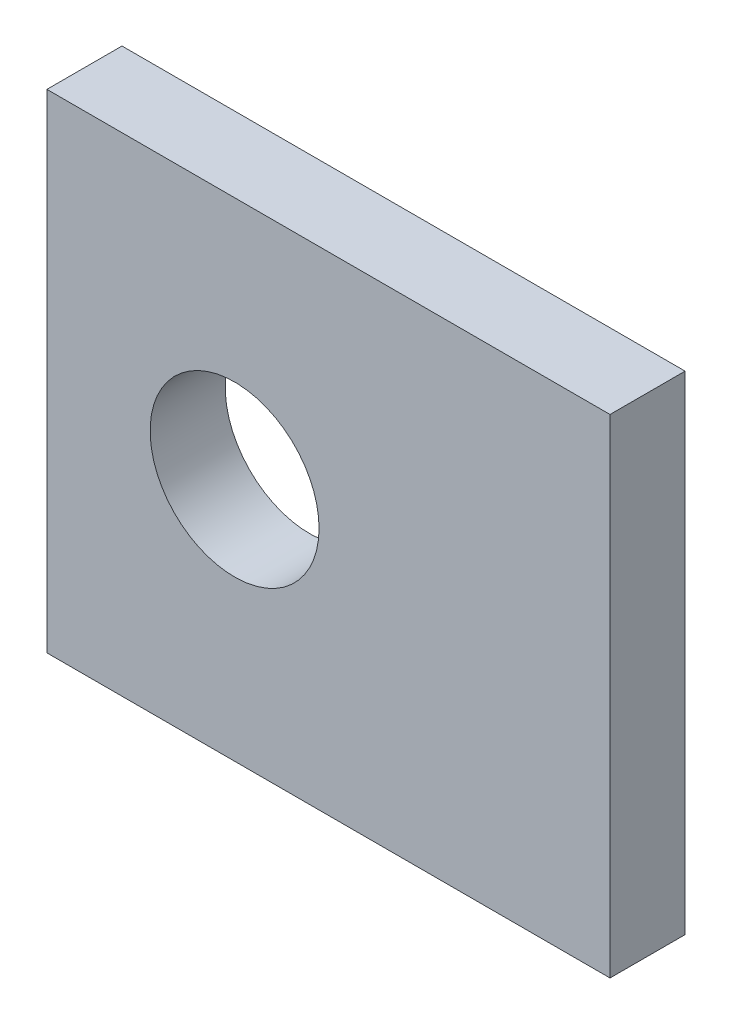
SolidWorks part; units mm, degrees
ref_plane "前视基准面" through (0, 0, 0) normal (0, 0, 1) x (1, 0, 0)
ref_plane "上视基准面" through (0, 0, 0) normal (0, 1, 0) x (1, 0, 0)
ref_plane "右视基准面" through (0, 0, 0) normal (1, 0, 0) x (0, 0, -1)
sketch "草图1" plane through (0, 0, 0) normal (0, 0, 1) x (1, 0, 0)
  line L0 (15, -13) -> (15, 0)
  line L1 (0, -13) -> (0, 0)
  line L2 (0, -13) -> (15, -13)
  line L3 (0, 0) -> (15, 0)
  circle A0 centre (5, -6.5) radius 2.25
extrude "凸台-拉伸1" add sketch "草图1" along normal blind 2
